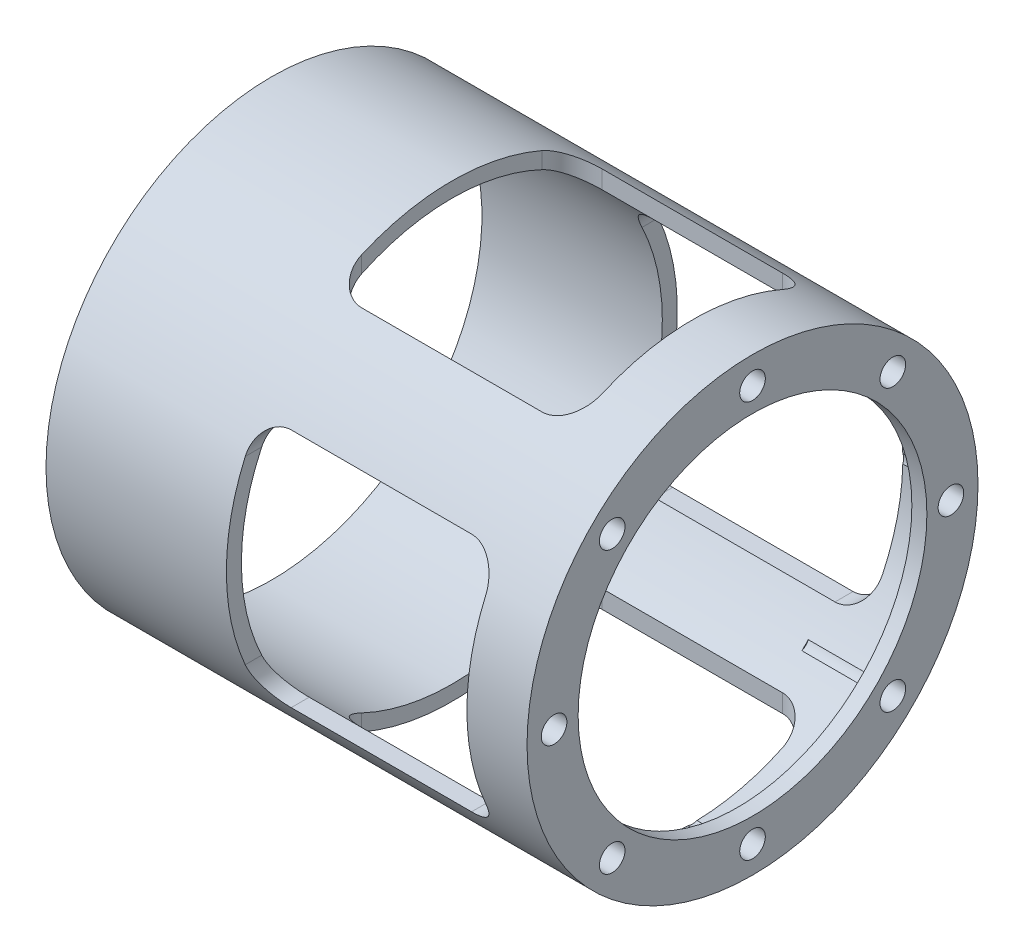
SolidWorks part; units mm, degrees
ref_plane "Front Plane" through (0, 0, 0) normal (0, 0, 1) x (1, 0, 0)
ref_plane "Top Plane" through (0, 0, 0) normal (0, 1, 0) x (1, 0, 0)
ref_plane "Right Plane" through (0, 0, 0) normal (1, 0, 0) x (0, 0, -1)
sketch "Sketch1" plane through (0, 0, 0) normal (0, 0, 1) x (1, 0, 0)
  line L0 (-44.5274, 0) -> (130.0317, 0) construction
  line L1 (0, 23.8125) -> (0, 18.415)
  line L2 (0, 18.415) -> (50.8, 18.415)
  line L3 (50.8, 18.415) -> (50.8, 23.8125)
  line L4 (50.8, 23.8125) -> (19.05, 23.8125)
  line L6 (19.05, 23.8125) -> (0, 23.8125)
  line L7 (50.8, 21.1138) -> (38.3731, 21.1137) construction
  line L8 (38.3731, 22.7647) -> (38.3731, 19.4628) construction
  line L9 (0, 22.225) -> (47.0128, 22.225)
  line L10 (47.0128, 22.225) -> (49.2125, 18.415)
  dimension "D1" = 1.5875
  dimension "D2" = 47.625
  dimension "D3" = 3.302
  dimension "D5" = 36.83
  dimension "D6" = 19.05
  dimension "D7" = 50.8
  dimension "D8" = 60
  dimension "D9" = 44.45
revolve "Revolve1" add sketch "Sketch1" angle 360 about L0
sketch "Sketch2" plane through (50.8, 0, 0) normal (1, 0, 0) x (0, 0, -1)
  circle A0 centre (0, 20.955) radius 1.3525
  dimension "D2" = 2.7051
  dimension "D1" = 20.955
extrude "Cut-Extrude1" cut sketch "Sketch2" against normal blind 10.16
pattern_circular "CirPattern1" count 8 over 360 about axis through (0, 0, 0) along (1, 0, 0) of "Cut-Extrude1"
ref_plane "Plane1" through (0, 0, 0) normal (0, 1, 0) x (1, 0, 0)
sketch "Sketch4" plane through (0, 0, 0) normal (0, 1, 0) x (1, 0, 0)
  line L0 (-200044.5274, 0) -> (200130.0317, 0) construction
  line L1 (22.225, -12.7) -> (41.275, -12.7)
  line L2 (19.05, -9.525) -> (19.05, 9.525)
  line L3 (22.225, 12.7) -> (41.275, 12.7)
  line L4 (44.45, -9.525) -> (44.45, 9.525)
  line L5 (19.05, -12.7) -> (44.45, 12.7) construction
  line L6 (19.05, 12.7) -> (44.45, -12.7) construction
  line L7 (50.8, -23.8125) -> (50.8, 23.8125) construction
  arc A0 (44.45, 9.525) -> (41.275, 12.7) centre (41.275, 9.525) ccw
  arc A1 (44.45, -9.525) -> (41.275, -12.7) centre (41.275, -9.525) cw
  arc A2 (22.225, -12.7) -> (19.05, -9.525) centre (22.225, -9.525) cw
  arc A3 (19.05, 9.525) -> (22.225, 12.7) centre (22.225, 9.525) cw
  point P0 (31.75, 0)
  dimension "D4" = 3.175
  dimension "D1" = 6.35
  dimension "D2" = 25.4
  dimension "D3" = 25.4
extrude "Cut-Extrude2" cut sketch "Sketch4" against normal through all
pattern_circular "CirPattern2" count 4 over 360 about axis through (0, 0, 0) along (1, 0, 0) of "Cut-Extrude2"
